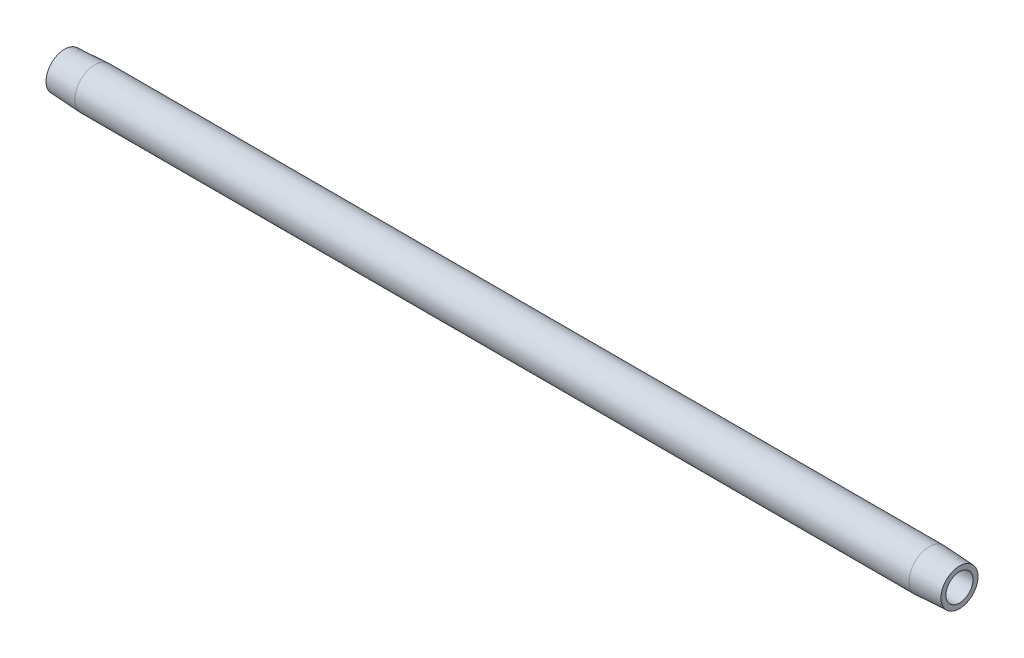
SolidWorks part; units mm, degrees
ref_plane "Front Plane" through (0, 0, 0) normal (0, 0, 1) x (1, 0, 0)
ref_plane "Top Plane" through (0, 0, 0) normal (0, 1, 0) x (1, 0, 0)
ref_plane "Right Plane" through (0, 0, 0) normal (1, 0, 0) x (0, 0, -1)
sketch "Sketch1" plane through (0, 0, 0) normal (0, 1, 0) x (1, 0, 0)
  line L6 (304.8, 4.6228) -> (0, 4.6228)
  line L7 (10.3124, 6.858) -> (0, 6.3175)
  line L8 (0, 6.3175) -> (0, 4.6228)
  line L9 (294.4876, 6.858) -> (10.3124, 6.858)
  line L10 (304.8, 6.3175) -> (294.4876, 6.858)
  line L11 (304.8, 4.6228) -> (304.8, 6.3175)
  line L12 (-6.376, 0) -> (49993.624, 0) construction
  dimension "D1" = 9.2456
  dimension "D2" = 13.716
  dimension "D3" = 3
  dimension "D4" = 3
  dimension "D5" = 304.8
  dimension "D6" = 10.3124
  dimension "D7" = 10.3124
revolve "Revolve1" add sketch "Sketch1" angle 360 about L12
